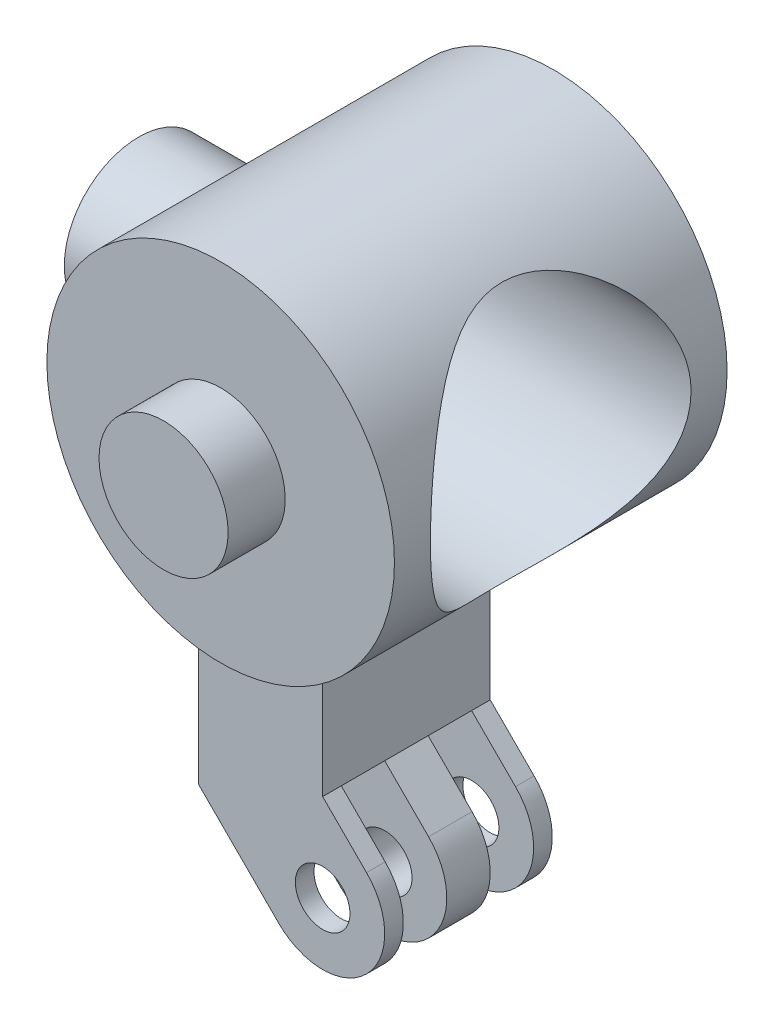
SolidWorks part; units mm, degrees
other "<brazoIzquierdo2>-<<SimetríaCopia de brazoIzquierdo>-<<Copia de brazoIzquierdo>-<Cortar-Extruir4>>>"
ref_plane "Alzado" through (0, 0, 0) normal (0, 0, 1) x (1, 0, 0)
ref_plane "Planta" through (0, 0, 0) normal (0, 1, 0) x (1, 0, 0)
ref_plane "Vista lateral" through (0, 0, 0) normal (1, 0, 0) x (0, 0, -1)
mirrored part "brazoIzquierdo2_Simétrica"
sketch "Croquis2" plane through (-30.5876, 0, 0) normal (1, 0, 0) x (0, 0, -1)
  circle A0 centre (5, 51.1546) radius 5.25
  dimension "D1" = 10.5
extrude "Cortar-Extruir1" cut sketch "Croquis2" along normal through all
sketch "Croquis3" plane through (-38.5876, 0, 0) normal (-1, 0, 0) x (0, 0, 1)
  circle A0 centre (-5, 51.1546) radius 1.75
  dimension "D1" = 3.5
extrude "Cortar-Extruir2" cut sketch "Croquis3" against normal through all both and the other way through all
sketch "Croquis4" plane through (0, 0, -4.9076) normal (0, 0, 1) x (1, 0, 0)
  line L0 (-33.5876, 35.3676) -> (-28.5876, 37.4386)
  line L4 (-33.5876, 46.2556) -> (-33.5876, 35.3676)
  line L5 (-33.5876, 35.3676) -> (-30.3554, 32.1353)
  line L6 (-26.8198, 35.6709) -> (-28.5876, 37.4386)
  line L13 (-33.5876, 46.2556) -> (-33.5876, 35.3676)
  line L14 (-28.5876, 37.4386) -> (-28.5876, 44.1546)
  line L15 (-28.5876, 37.4386) -> (-28.5876, 44.1546)
  arc A2 (-33.5876, 46.2556) -> (-28.5876, 44.1546) centre (-28.5876, 51.1546) ccw
  arc A3 (-30.3554, 32.1353) -> (-26.8198, 35.6709) centre (-28.5876, 33.9031) ccw
  arc A5 (-33.5876, 46.2556) -> (-28.5876, 44.1546) centre (-28.5876, 51.1546) ccw
  dimension "D1" = 0
extrude "Saliente-Extruir1" add sketch "Croquis4" along normal blind 1.75
sketch "Croquis5" plane through (0, 0, -3.1576) normal (0, 0, 1) x (1, 0, 0)
  line L3 (-33.5876, 46.2556) -> (-33.5876, 35.3676)
  line L4 (-33.5876, 35.3676) -> (-28.5876, 37.4386)
  line L5 (-28.5876, 37.4386) -> (-28.5876, 44.1546)
  line L6 (-33.5876, 46.2556) -> (-33.5876, 35.3676)
  line L8 (-28.5876, 37.4386) -> (-28.5876, 44.1546)
  line L9 (-26.8198, 35.6709) -> (-28.5876, 37.4386)
  line L10 (-28.5876, 37.4386) -> (-33.5876, 35.3676)
  line L11 (-33.5876, 35.3676) -> (-30.3554, 32.1353)
  line L12 (-26.8198, 35.6709) -> (-28.5876, 37.4386)
  line L14 (-33.5876, 35.3676) -> (-30.3554, 32.1353)
  circle A0 centre (-28.5876, 33.9031) radius 1.1
  arc A1 (-33.5876, 46.2556) -> (-28.5876, 44.1546) centre (-28.5876, 51.1546) ccw
  arc A2 (-33.5876, 46.2556) -> (-28.5876, 44.1546) centre (-28.5876, 51.1546) ccw
  arc A3 (-30.3554, 32.1353) -> (-26.8198, 35.6709) centre (-28.5876, 33.9031) ccw
  arc A4 (-30.3554, 32.1353) -> (-26.8198, 35.6709) centre (-28.5876, 33.9031) ccw
  dimension "D1" = 0
  dimension "D2" = 0
extrude "Saliente-Extruir2" add sketch "Croquis5" along normal blind 0.75
sketch "Croquis6" plane through (0, 0, -6.6576) normal (0, 0, -1) x (-1, 0, 0)
  line L0 (28.5876, 37.4386) -> (33.5876, 35.3676)
  line L4 (28.5876, 44.1546) -> (28.5876, 37.4386)
  line L5 (28.5876, 37.4386) -> (26.8198, 35.6709)
  line L6 (30.3554, 32.1353) -> (33.5876, 35.3676)
  line L13 (28.5876, 44.1546) -> (28.5876, 37.4386)
  line L14 (33.5876, 35.3676) -> (33.5876, 46.2556)
  line L15 (33.5876, 35.3676) -> (33.5876, 46.2556)
  arc A2 (28.5876, 44.1546) -> (33.5876, 46.2556) centre (28.5876, 51.1546) ccw
  arc A3 (26.8198, 35.6709) -> (30.3554, 32.1353) centre (28.5876, 33.9031) ccw
  arc A5 (28.5876, 44.1546) -> (33.5876, 46.2556) centre (28.5876, 51.1546) ccw
  dimension "D1" = 0
extrude "Saliente-Extruir3" add sketch "Croquis6" along normal blind 1.75
sketch "Croquis7" plane through (0, 0, -8.4076) normal (0, 0, -1) x (-1, 0, 0)
  line L3 (28.5876, 44.1546) -> (28.5876, 37.4386)
  line L4 (28.5876, 37.4386) -> (33.5876, 35.3676)
  line L5 (33.5876, 35.3676) -> (33.5876, 46.2556)
  line L6 (28.5876, 44.1546) -> (28.5876, 37.4386)
  line L8 (33.5876, 35.3676) -> (33.5876, 46.2556)
  line L9 (30.3554, 32.1353) -> (33.5876, 35.3676)
  line L10 (33.5876, 35.3676) -> (28.5876, 37.4386)
  line L11 (28.5876, 37.4386) -> (26.8198, 35.6709)
  line L12 (30.3554, 32.1353) -> (33.5876, 35.3676)
  line L14 (28.5876, 37.4386) -> (26.8198, 35.6709)
  circle A0 centre (28.5876, 33.9031) radius 1.1
  arc A1 (28.5876, 44.1546) -> (33.5876, 46.2556) centre (28.5876, 51.1546) ccw
  arc A2 (28.5876, 44.1546) -> (33.5876, 46.2556) centre (28.5876, 51.1546) ccw
  arc A3 (26.8198, 35.6709) -> (30.3554, 32.1353) centre (28.5876, 33.9031) ccw
  arc A4 (26.8198, 35.6709) -> (30.3554, 32.1353) centre (28.5876, 33.9031) ccw
  dimension "D1" = 0
  dimension "D2" = 0
extrude "Saliente-Extruir4" add sketch "Croquis7" along normal blind 0.75
